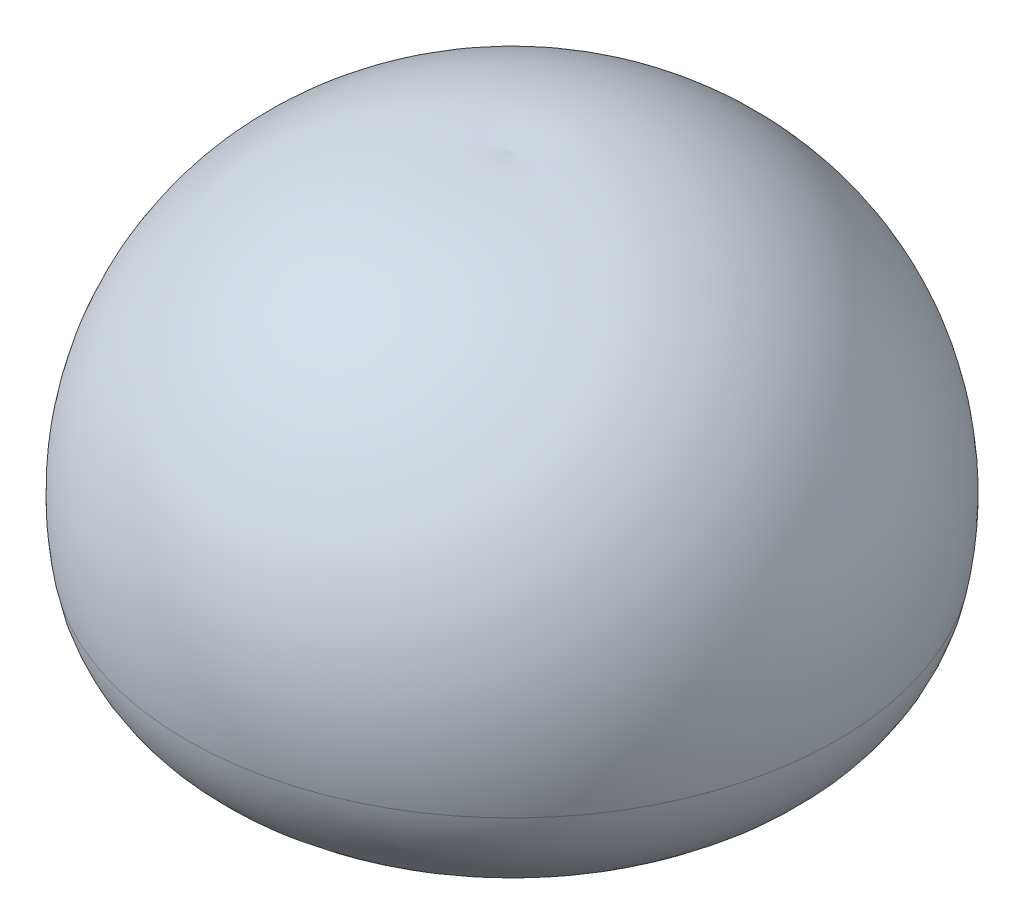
SolidWorks part; units mm, degrees
ref_plane "前视基准面" through (0, 0, 0) normal (0, 0, 1) x (1, 0, 0)
ref_plane "上视基准面" through (0, 0, 0) normal (0, 1, 0) x (1, 0, 0)
ref_plane "右视基准面" through (0, 0, 0) normal (1, 0, 0) x (0, 0, -1)
sketch "草图1" plane through (0, 0, 0) normal (0, 0, 1) x (1, 0, 0)
  line L0 (0, 0) -> (0, 1951.8831) construction
  line L15 (0, 1095.575) -> (0, 2901.6649)
  arc A0 (2519.7493, 210.282) -> (0, 2901.6649) centre (250, 610.5) ccw
  arc A1 (306.9067, 110.7397) -> (25.5971, 1060.6578) centre (250, 610.5) ccw
  arc A2 (306.9067, 110.7397) -> (2519.7493, 210.282) centre (1402.2251, 407.3316) ccw
  arc A4 (25.5971, 1060.6578) -> (0, 1095.575) centre (-902.2251, 407.3316) ccw
revolve "旋转1" add sketch "草图1" angle 360 about L0
